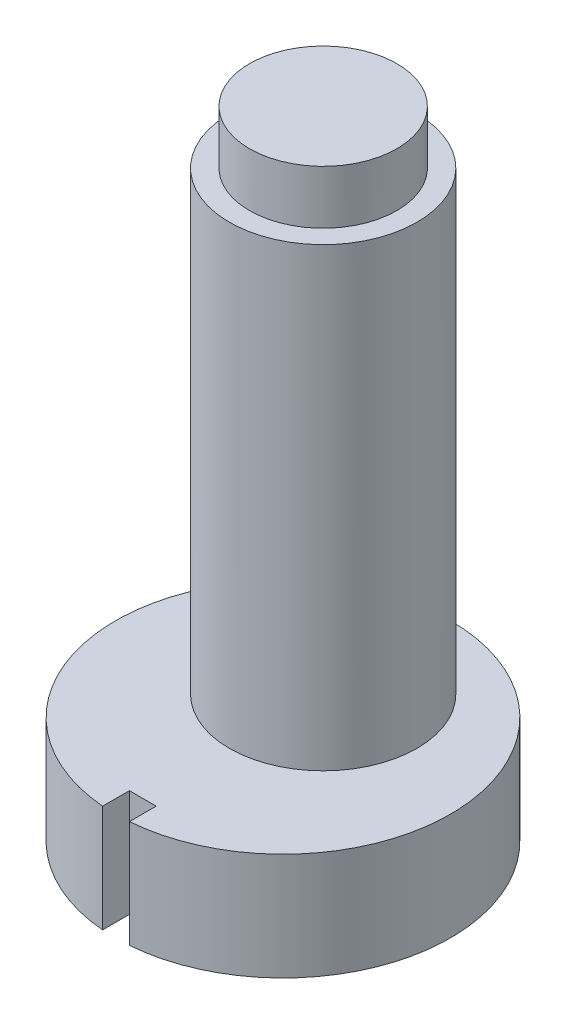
SolidWorks part; units mm, degrees
ref_plane "Front Plane" through (0, 0, 0) normal (0, 0, 1) x (1, 0, 0)
ref_plane "Top Plane" through (0, 0, 0) normal (0, 1, 0) x (1, 0, 0)
ref_plane "Right Plane" through (0, 0, 0) normal (1, 0, 0) x (0, 0, -1)
sketch "Sketch1" plane through (0, 0, 0) normal (0, 1, 0) x (1, 0, 0)
  circle A0 centre (0, 0) radius 6.25
  dimension "D1" = 12.5
extrude "Boss-Extrude1" add sketch "Sketch1" along normal blind 4
sketch "Sketch3" plane through (0, 4, 0) normal (0, 1, 0) x (1, 0, 0)
  line L0 (0, -1000) -> (0, 49000) construction
  circle A1 centre (0, 1.5) radius 3.5
  circle A5 centre (0, 0) radius 5 construction
  dimension "D1" = 7
  dimension "D2" = 10
extrude "Boss-Extrude2" add sketch "Sketch3" along normal blind 17
sketch "Sketch6" plane through (0, 21, 0) normal (0, 1, 0) x (1, 0, 0)
  line L0 (0, -1000) -> (0, 49000) construction
  line L1 (-996.5, 1.5) -> (49003.5, 1.5) construction
  circle A2 centre (0, 1.5) radius 2.75
  dimension "D2" = 5.5
  dimension "D1" = 1.5
extrude "Boss-Extrude4" add sketch "Sketch6" along normal blind 2
sketch "Sketch7" plane through (0, 4, 0) normal (0, 1, 0) x (1, 0, 0)
  line L0 (0, -1000) -> (0, 49000) construction
  line L1 (-0.5, -6.23) -> (-0.5, -5.23)
  line L2 (-0.5, -5.23) -> (0.5, -5.23)
  line L3 (0.5, -5.23) -> (0.5, -6.23)
  circle A0 centre (0, 0) radius 6.25 construction
  arc A1 (-0.5, -6.23) -> (0.5, -6.23) centre (0, 0) ccw
  point P7 (0, -5.23)
  dimension "D1" = 6.25
  dimension "D2" = 1
  dimension "D3" = 1
extrude "Cut-Extrude1" cut sketch "Sketch7" against normal up to next
sketch "Sketch8" plane through (0, 21, 0) normal (0, 1, 0) x (1, 0, 0)
  line L0 (0, -1000) -> (0, 49000) construction
  line L1 (-1000, 0) -> (49000, 0) construction
  line L2 (-2.75, 1.5) -> (-3.5, 1.5)
  line L3 (0, 4.25) -> (0, 5)
  line L4 (0, 1.5) -> (-45687.915, 20314.4128) construction
  line L5 (-2.5128, 2.6172) -> (-2.5128, 3.9363)
  line L6 (-2.5128, 2.6172) -> (-3.4922, 1.7335)
  circle A0 centre (0, 1.5) radius 3.5
  circle A1 centre (0, 1.5) radius 3.5 construction
  circle A2 centre (0, 1.5) radius 2.75
  circle A3 centre (0, 1.5) radius 2.75 construction
  dimension "D1" = 23.97
extrude "Cut-Extrude2" cut sketch "Sketch8" against normal blind 10 contours L6 L5 M7
